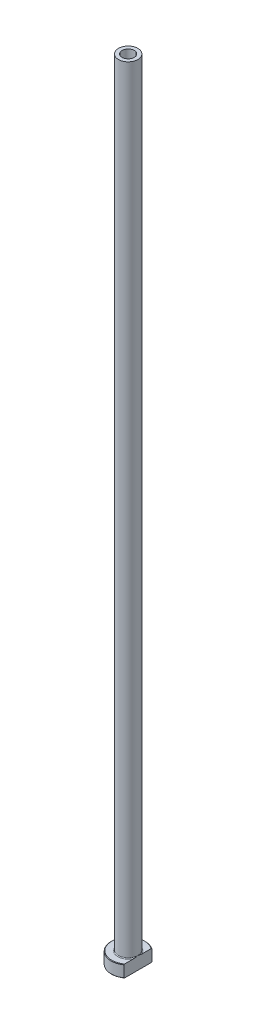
SolidWorks part; units mm, degrees
ref_plane "Front Plane" through (0, 0, 0) normal (0, 0, 1) x (1, 0, 0)
ref_plane "Top Plane" through (0, 0, 0) normal (0, 1, 0) x (1, 0, 0)
ref_plane "Right Plane" through (0, 0, 0) normal (1, 0, 0) x (0, 0, -1)
sketch "Sketch1" plane through (0, 0, 0) normal (0, 0, 1) x (1, 0, 0)
  line L0 (-2.5, 325) -> (-4, 325)
  line L1 (-4, 325) -> (-4, 5)
  line L2 (-4, 5) -> (-7, 5)
  line L3 (-7, 5) -> (-7, 0)
  line L4 (6.05, 0) -> (-6.05, 0) construction
  line L5 (-7, 0) -> (-2.75, 0)
  line L6 (-2.5, 280) -> (-2.5, 325)
  line L7 (0, 92.1877) -> (0, -15.5353) construction
  line L8 (0, -7.7) -> (0, 7.7) construction
  line L9 (-2.5, 280) -> (-2.75, 268)
  line L10 (-2.75, 268) -> (-2.75, 0)
  dimension "D1" = 0.25
  dimension "ID" = 5
  dimension "OD" = 8
  dimension "L" = 325
  dimension "H" = 14
  dimension "T" = 5
  dimension "N" = 45
  dimension "D2" = 12
  dimension "L-N" = 280
revolve "Revolve1" add sketch "Sketch1" angle 360 about L7
fillet "Fillet1" radius 0.3 1 edges at (0, 5, 4)
chamfer "Chamfer1" distance 0.2 angle 45 2 edges at (0, 5, 7) (0, 0, 7)
sketch "Sketch2" plane through (0, 0, 0) normal (0, -1, 0) x (1, 0, 0)
  line L0 (4, 5.7446) -> (4, -5.7446)
  circle A0 centre (0, 0) radius 7 construction
  arc A1 (4, 5.7446) -> (4, -5.7446) centre (0, 0) cw
  circle A2 centre (0, 0) radius 4 construction
extrude "Cut-Extrude1" cut sketch "Sketch2" against normal through all
chamfer "Chamfer2" distance 0.5 angle 45 1 edges at (0, 0, 2.75)
